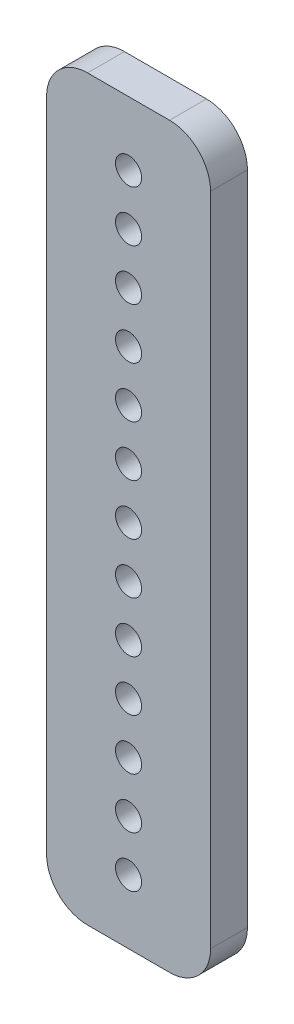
SolidWorks part; units mm, degrees
ref_plane "Front Plane" through (0, 0, 0) normal (0, 0, 1) x (1, 0, 0)
ref_plane "Top Plane" through (0, 0, 0) normal (0, 1, 0) x (1, 0, 0)
ref_plane "Right Plane" through (0, 0, 0) normal (1, 0, 0) x (0, 0, -1)
sketch "Sketch1" plane through (0, 0, 0) normal (0, 0, 1) x (1, 0, 0)
  line L1 (-12.7, 57.15) -> (12.7, 57.15)
  line L2 (-12.7, 57.15) -> (-12.7, -57.15)
  line L3 (-12.7, -57.15) -> (12.7, -57.15)
  line L4 (12.7, 57.15) -> (12.7, -57.15)
  line L5 (-12.7, 57.15) -> (12.7, -57.15) construction
  line L6 (-12.7, -57.15) -> (12.7, 57.15) construction
  point P0 (0, 0)
  dimension "D1" = 25.4
  dimension "D2" = 114.3
extrude "Boss-Extrude1" add sketch "Sketch1" along normal blind 5.715
sketch "Sketch2" plane through (0, 0, 5.715) normal (0, 0, 1) x (1, 0, 0)
  line L0 (0, 0) -> (0, 7.874) construction
  circle A0 centre (0, 0) radius 2.0193
  circle A1 centre (0, 7.874) radius 2.0193
  circle A2 centre (0, 15.748) radius 2.0193
  circle A3 centre (0, 23.622) radius 2.0193
  circle A4 centre (0, 31.496) radius 2.0193
  circle A5 centre (0, 39.37) radius 2.0193
  circle A6 centre (0, 47.244) radius 2.0193
  circle A8 centre (0, -7.874) radius 2.0193
  circle A9 centre (0, -15.748) radius 2.0193
  circle A10 centre (0, -23.622) radius 2.0193
  circle A11 centre (0, -31.496) radius 2.0193
  circle A12 centre (0, -39.37) radius 2.0193
  circle A13 centre (0, -47.244) radius 2.0193
  dimension "D1" = 4.0386
  dimension "D2" = 7.874
  dimension "D4" = 7
  dimension "D3" = 7
extrude "Cut-Extrude1" cut sketch "Sketch2" against normal blind 5.715
fillet "Fillet1" radius 6.35 4 edges at (12.7, -57.15, 2.8575) (-12.7, -57.15, 2.8575) (12.7, 57.15, 2.8575) (-12.7, 57.15, 2.8575)
